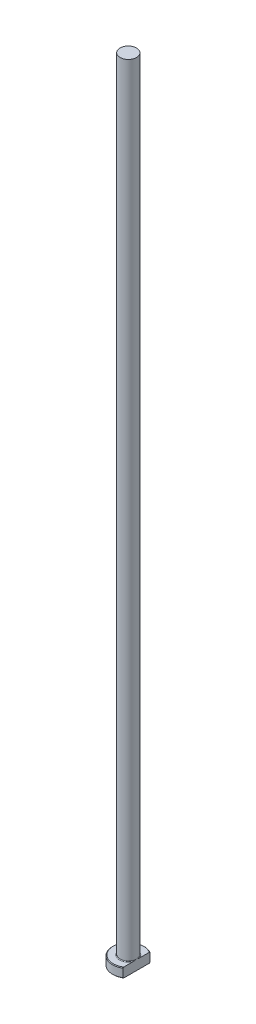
SolidWorks part; units mm, degrees
ref_plane "Front Plane" through (0, 0, 0) normal (0, 0, 1) x (1, 0, 0)
ref_plane "Top Plane" through (0, 0, 0) normal (0, 1, 0) x (1, 0, 0)
ref_plane "Right Plane" through (0, 0, 0) normal (1, 0, 0) x (0, 0, -1)
sketch "Sketch1" plane through (0, 0, 0) normal (0, 0, 1) x (1, 0, 0)
  line L0 (0, 259.9588) -> (0, -15.1925) construction
  line L1 (0, 0) -> (-5, 0)
  line L2 (-5, 0) -> (-5, 3)
  line L3 (-5, 3) -> (-2.6, 3)
  line L4 (-2.6, 3) -> (-2.6, 250)
  line L5 (-2.6, 250) -> (0, 250)
  line L6 (0, 250) -> (0, 0)
  dimension "L" = 250
  dimension "H" = 10
  dimension "T" = 3
  dimension "D" = 5.2
revolve "Revolve1" add sketch "Sketch1" angle 360 about L0
chamfer "Chamfer1" distance 0.2 angle 45 2 edges at (0, 3, 5) (0, 0, 5)
fillet "Fillet1" radius 0.2 1 edges at (0, 3, 2.6)
sketch "Sketch2" plane through (0, 0, 0) normal (0, 1, 0) x (1, 0, 0)
  line L0 (2.6, 4.2708) -> (2.6, -4.2708)
  circle A0 centre (0, 0) radius 5 construction
  arc A1 (2.6, -4.2708) -> (2.6, 4.2708) centre (0, 0) ccw
  circle A2 centre (0, 0) radius 2.6 construction
extrude "KEY" cut sketch "Sketch2" along normal through all
